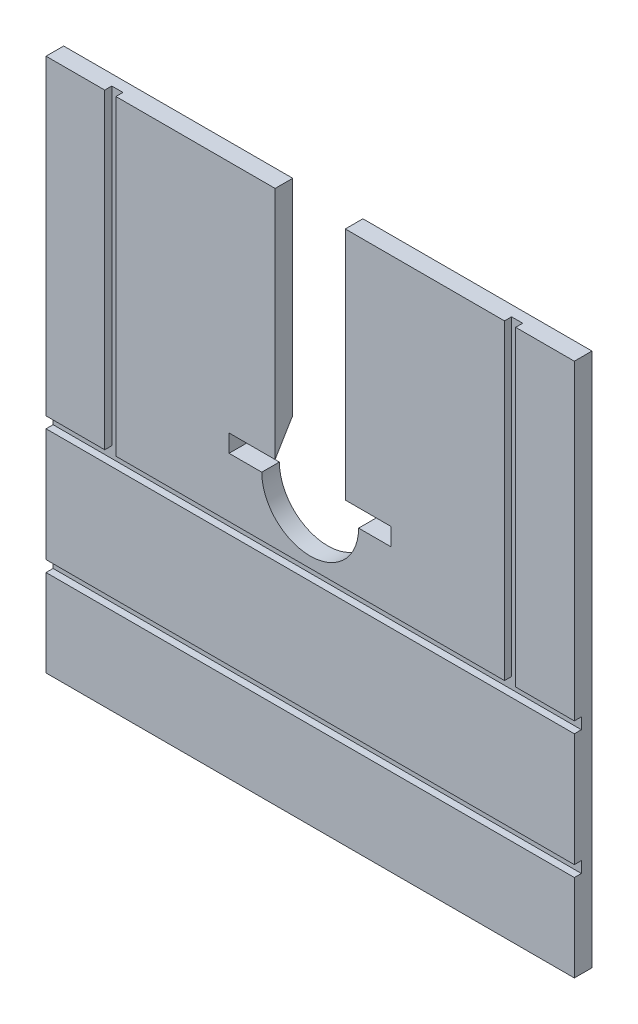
SolidWorks part; units mm, degrees
ref_plane "Piano frontale" through (0, 0, 0) normal (0, 0, 1) x (1, 0, 0)
ref_plane "Piano superiore" through (0, 0, 0) normal (0, 1, 0) x (1, 0, 0)
ref_plane "Piano destro" through (0, 0, 0) normal (1, 0, 0) x (0, 0, -1)
sketch "Schizzo1" plane through (0, 0, 0) normal (0, 0, 1) x (1, 0, 0)
  line L0 (-59.7766, 430) -> (-450, 430)
  line L1 (450, 430) -> (59.7766, 430)
  line L2 (450, 430) -> (450, -480)
  line L3 (450, -480) -> (-450, -480)
  line L4 (-450, 430) -> (-450, -480)
  line L7 (-59.7766, 30) -> (-138.2234, 30)
  line L8 (-59.7766, 430) -> (-59.7766, 30)
  line L9 (-138.2234, 30) -> (-138.2234, 0)
  line L10 (59.7766, 430) -> (59.7766, 30)
  line L11 (-138.2234, 0) -> (137.7766, 0) construction
  line L12 (59.7766, 30) -> (137.7766, 30)
  line L13 (-59.7766, 30) -> (-67.7766, 30) construction
  line L14 (137.7766, 30) -> (137.7766, 0)
  line L15 (59.7766, 30) -> (67.7766, 30) construction
  line L16 (-138.2234, 0) -> (-82.5, 0)
  line L17 (137.7766, 0) -> (82.5, 0)
  arc A0 (-82.5, 0) -> (82.5, 0) centre (0, 0) ccw
  point P0 (0, 0)
  dimension "D1" = 82.5
  dimension "D2" = 59.7766
  dimension "D3" = 137.7766
  dimension "D4" = 450
  dimension "D5" = 59.7766
  dimension "D6" = 138.2234
  dimension "D7" = 450
  dimension "D8" = 30
  dimension "D9" = 430
  dimension "D10" = 480
extrude "Estrusione-Estrusione1" add sketch "Schizzo1" along normal blind 30
sketch "Schizzo2" plane through (0, 0, 30) normal (0, 0, 1) x (1, 0, 0)
  line L0 (-450, -100.7094) -> (450, -100.7094)
  line L1 (-450, 430) -> (-450, -480) construction
  line L2 (450, -480) -> (450, 430) construction
  line L3 (450, -100.7094) -> (450, -119.7094)
  line L4 (450, -119.7094) -> (-450, -119.7094)
  line L5 (-450, -119.7094) -> (-450, -100.7094)
extrude "Taglio-Estrusione1" cut sketch "Schizzo2" against normal blind 12
sketch "Schizzo3" plane through (0, 0, 30) normal (0, 0, 1) x (1, 0, 0)
  line L0 (450, -119.7094) -> (450, -312.763) construction
  line L1 (450, -480) -> (450, -119.7094) construction
  line L2 (450, -312.763) -> (-450, -312.763)
  line L3 (-450, -119.7094) -> (-450, -480) construction
  line L4 (-450, -312.763) -> (-450, -331.763)
  line L5 (-450, -331.763) -> (450, -331.763)
  line L6 (450, -331.763) -> (450, -312.763)
extrude "Taglio-Estrusione3" cut sketch "Schizzo3" against normal blind 12
sketch "Schizzo10" plane through (-59.7766, 0, 0) normal (1, 0, 0) x (0, 0, -1)
  line L0 (-30, 30) -> (0, 79.8468)
  line L1 (0, 30) -> (0, 430) construction
  line L2 (0, 79.8468) -> (0, 30)
  line L3 (0, 30) -> (-30, 30)
extrude "Taglio-Estrusione7" cut sketch "Schizzo10" against normal blind 23
sketch "Schizzo12" plane through (59.7766, 0, 0) normal (-1, 0, 0) x (0, 0, 1)
  line L0 (30, 30) -> (0, 79.8468)
  line L1 (0, 430) -> (0, 30) construction
  line L2 (0, 79.8468) -> (0, 30)
  line L3 (0, 30) -> (30, 30)
extrude "Taglio-Estrusione8" cut sketch "Schizzo12" against normal blind 23
sketch "Schizzo13" plane through (0, 0, 30) normal (0, 0, 1) x (1, 0, 0)
  line L0 (-349.9986, 430) -> (-349.9986, -100.7094)
  line L1 (-59.7766, 430) -> (-450, 430) construction
  line L2 (-349.9986, 430) -> (-349.9986, -100.7094) construction
  line L3 (450, -100.7094) -> (-450, -100.7094) construction
  line L4 (-349.9986, -100.7094) -> (-330.9986, -100.7094)
  line L5 (-330.9986, -100.7094) -> (-330.9986, 430)
  line L6 (-330.9986, 430) -> (-349.9986, 430)
  line L7 (0, 0) -> (0, 23.6289) construction
  line L8 (330.9986, 430) -> (349.9986, 430)
  line L9 (349.9986, 430) -> (349.9986, -100.7094)
  line L10 (349.9986, -100.7094) -> (330.9986, -100.7094)
  line L11 (330.9986, -100.7094) -> (330.9986, 430)
extrude "Taglio-Estrusione9" cut sketch "Schizzo13" against normal blind 12
sketch "Sketch1" plane through (0, 0, 30) normal (0, 0, 1) x (1, 0, 0)
  line L0 (0, 0) -> (0, 430) construction
  line L1 (0, 430) -> (330.9986, 430) construction
